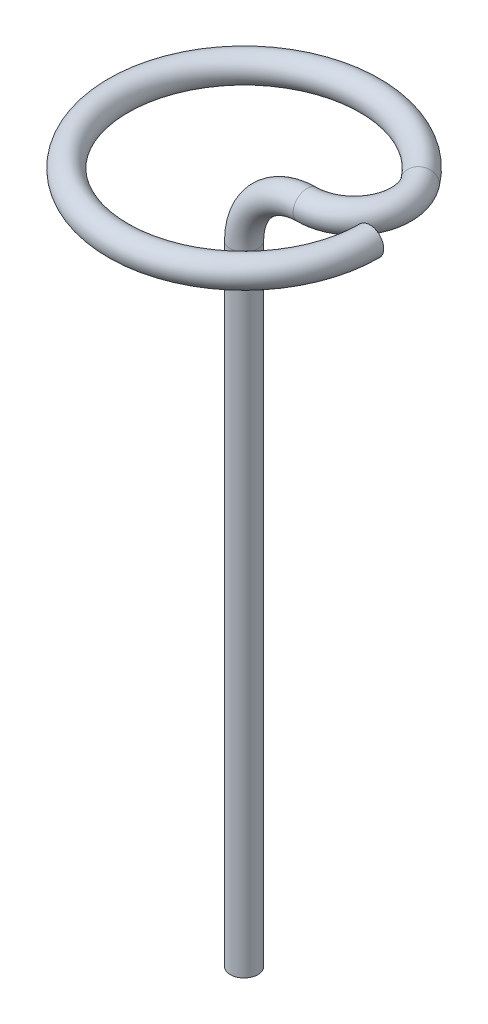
SolidWorks part; units mm, degrees
ref_plane "Front Plane" through (0, 0, 0) normal (0, 0, 1) x (1, 0, 0)
ref_plane "Top Plane" through (0, 0, 0) normal (0, 1, 0) x (1, 0, 0)
ref_plane "Right Plane" through (0, 0, 0) normal (1, 0, 0) x (0, 0, -1)
sketch "Sketch1" plane through (0, 0, 0) normal (0, 0, 1) x (1, 0, 0)
  line L0 (0, -1.27) -> (0, -13.97)
  line L1 (1.27, 0) -> (6.0964, 0) construction
  arc A0 (0, -1.27) -> (1.27, 0) centre (1.27, -1.27) cw
  dimension "D1" = 1.27
  dimension "D2" = 12.7
sketch "Sketch2" plane through (0, 0, 0) normal (0, 1, 0) x (1, 0, 0)
  line L0 (1.27, 0) -> (6.0964, 0) construction
  line L1 (1.27, 0) -> (6.0964, 0) construction
  arc A0 (1.27, 0) -> (2.032, 1.524) centre (1.27, 0.9525) ccw
  arc A1 (2.032, 1.524) -> (2.54, 0) centre (0, 0) ccw
  dimension "D1" = 5.08
sketch "Sketch3" plane through (0, 0, 0) normal (0, 0, 1) x (1, 0, 0)
  circle A0 centre (2.54, 0) radius 0.2794
  dimension "D1" = 0.5588
sketch3d "3DSketch1"
  line L0 (0, -1.27, 0) -> (0, -13.97, 0) construction
  line L1 (0, -1.27, 0) -> (0, -13.97, 0)
  arc A0 (0, -1.27, 0) -> (1.27, 0, 0) centre (1.27, -1.27, 0) ccw construction
  arc A1 (1.27, 0, 0) -> (2.032, 0, -1.524) centre (1.27, 0, -0.9525) ccw construction
  arc A2 (2.032, 0, -1.524) -> (2.54, 0, 0) centre (0, 0, 0) ccw construction
  arc A3 (0, -1.27, 0) -> (1.27, 0, 0) centre (1.27, -1.27, 0) ccw
  arc A4 (1.27, 0, 0) -> (2.032, 0, -1.524) centre (1.27, 0, -0.9525) ccw
  arc A5 (2.032, 0, -1.524) -> (2.54, 0, 0) centre (0, 0, 0) ccw
  point P5 (1.27, -1.27, -1.27)
  point P8 (1.27, 0.9525, -0.9525)
  point P9 (1.27, -1.27, -1.27)
  point P11 (0, 2.54, 0)
  point P12 (1.27, 0.9525, -0.9525)
  point P13 (0, 2.54, 0)
sweep "Sweep3" add profiles "Sketch3" path "3DSketch1"
